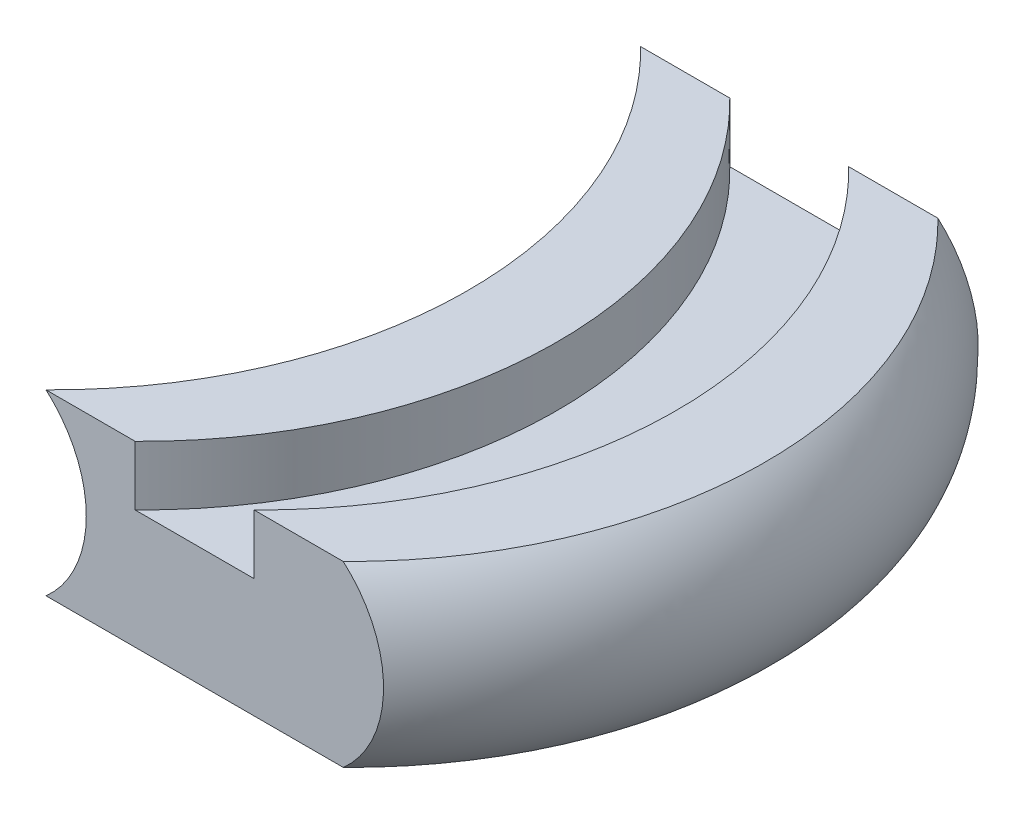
SolidWorks part; units mm, degrees
ref_plane "Front Plane" through (0, 0, 0) normal (0, 0, 1) x (1, 0, 0)
ref_plane "Top Plane" through (0, 0, 0) normal (0, 1, 0) x (1, 0, 0)
ref_plane "Right Plane" through (0, 0, 0) normal (1, 0, 0) x (0, 0, -1)
sketch "Sketch1" plane through (0, 0, 0) normal (0, 0, 1) x (1, 0, 0)
  line L1 (0, 30) -> (15, 30)
  line L2 (15, 30) -> (15, 20)
  line L3 (15, 20) -> (35, 20)
  line L4 (35, 20) -> (35, 30)
  line L5 (35, 30) -> (50, 30)
  line L7 (50, 0) -> (0, 0)
  arc A0 (0, 30) -> (0, 0) centre (-13.2288, 15) cw
  arc A1 (50, 30) -> (50, 0) centre (36.7712, 15) cw
  dimension "D5" = 20
  dimension "D1" = 50
  dimension "D2" = 30
  dimension "D3" = 20
  dimension "D4" = 10
ref_plane "Plane1" through (0, 0, 100) normal (0, 0, 1) x (1, 0, 0)
sketch "Sketch2" plane through (0, 0, 100) normal (0, 0, 1) x (1, 0, 0)
  line L9 (15, 30) -> (0, 30)
  line L10 (15, 20) -> (15, 30)
  line L11 (35, 20) -> (15, 20)
  line L12 (35, 30) -> (35, 20)
  line L13 (50, 30) -> (35, 30)
  line L15 (0, 0) -> (50, 0)
  line L17 (15, 30) -> (0, 30)
  line L18 (15, 20) -> (15, 30)
  line L19 (35, 20) -> (15, 20)
  line L20 (35, 30) -> (35, 20)
  line L21 (50, 30) -> (35, 30)
  line L23 (0, 0) -> (50, 0)
  arc A1 (0, 0) -> (0, 30) centre (-13.2288, 15) ccw
  arc A2 (0, 0) -> (0, 30) centre (-13.2288, 15) ccw
  arc A4 (50, 0) -> (50, 30) centre (36.7712, 15) ccw
  arc A5 (50, 0) -> (50, 30) centre (36.7712, 15) ccw
  dimension "D1" = 0
sketch "Sketch5" plane through (0, 0, 0) normal (0, 1, 0) x (1, 0, 0)
  arc A0 (50, 0) -> (50, -100) centre (1.0102, -50) cw
  dimension "D1" = 70
sketch "Sketch6" plane through (0, 0, 0) normal (0, 1, 0) x (1, 0, 0)
  line L0 (0, 0) -> (0, -100)
loft "Loft1" add profiles "Sketch2", "Sketch1"
